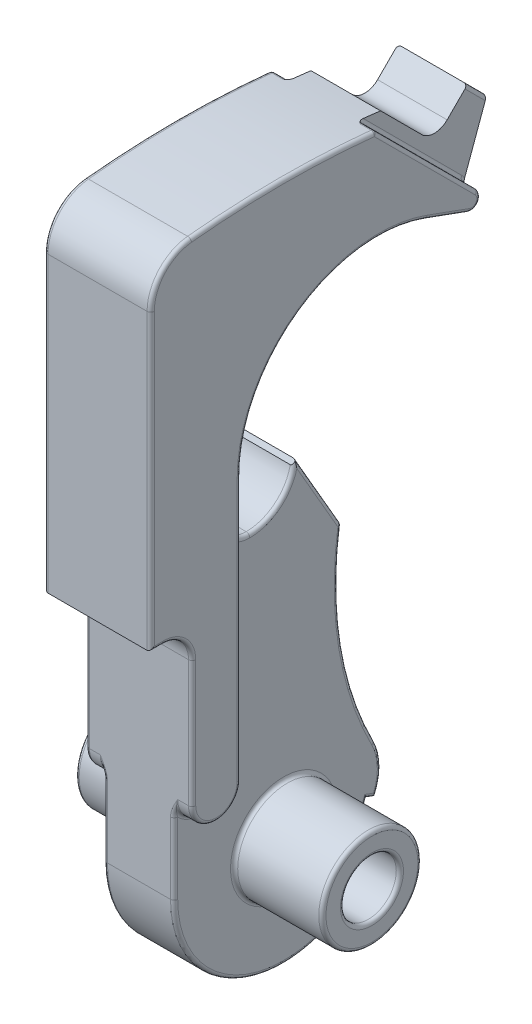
SolidWorks part; units mm, degrees
ref_plane "Front" through (0, 0, 0) normal (0, 0, 1) x (1, 0, 0)
ref_plane "Top" through (0, 0, 0) normal (0, 1, 0) x (1, 0, 0)
ref_plane "Right" through (0, 0, 0) normal (1, 0, 0) x (0, 0, -1)
sketch "Sketch1" plane through (0, 0, 0) normal (1, 0, 0) x (0, 0, -1)
  line L0 (0, 0) -> (16.1769, -5.8879) construction
  line L1 (7.2559, -2.6409) -> (5.3465, -1.946)
  line L2 (5.3465, -1.946) -> (5.8677, -0.5139)
  line L3 (5.8677, -0.5139) -> (6.4644, -0.731)
  line L4 (-4.2926, 30.0076) -> (-4.2926, 6.35) construction
  line L5 (0, 0) -> (-22.3437, 0) construction
  line L6 (-7.7216, 0) -> (-7.7216, 15.2654)
  line L7 (0, 0) -> (0, 17.145) construction
  line L8 (4.0854, 17.145) -> (0.9104, 22.6443)
  line L9 (-10.6426, 17.2974) -> (-9.7536, 17.2974)
  line L10 (-10.6426, 17.2974) -> (-10.6426, 37.9889)
  line L11 (-7.7256, 17.145) -> (4.0854, 17.145) construction
  line L12 (-10.6426, 41.4782) -> (5.2324, 41.4782) construction
  line L13 (-10.6426, 28.7569) -> (13.2334, 28.7569) construction
  line L14 (0, -7.7216) -> (-15.9042, -7.7216) construction
  line L15 (-10.6426, 17.2974) -> (-10.6426, 6.35) construction
  line L16 (-7.7892, 41.1476) -> (6.3959, 41.1476) construction
  line L17 (5.2324, 41.1476) -> (12.4166, 33.9634)
  line L18 (11.7504, 32.9177) -> (8.7669, 34.0036)
  line L19 (-4.2926, 24.8592) -> (-4.2926, 21.6842)
  line L20 (0.9104, 22.6443) -> (0.722, 22.3131)
  line L21 (0.722, 22.3131) -> (0.722, 19.7731) construction
  circle A0 centre (0, 0) radius 1.9685
  arc A1 (-7.7216, 0) -> (7.2559, -2.6409) centre (0, 0) ccw
  arc A2 (-7.7216, 15.2654) -> (-9.7536, 17.2974) centre (-9.7536, 15.2654) ccw
  arc A5 (-7.7892, 41.1476) -> (5.2324, 41.1476) centre (-1.2784, -22.7959) cw
  arc A6 (-10.6426, 37.9889) -> (-7.7892, 41.1476) centre (-7.4676, 37.9889) cw
  circle A7 centre (0, 0) radius 3.4925 construction
  arc A8 (-4.2926, 6.35) -> (-7.7216, 6.35) centre (-6.0071, 6.35) cw construction
  arc A9 (12.4166, 33.9634) -> (11.7504, 32.9177) centre (11.9676, 33.5144) cw
  arc A10 (8.7669, 34.0036) -> (-4.2926, 24.8592) centre (5.4386, 24.8592) ccw
  arc A11 (-4.2926, 21.6842) -> (-2.3876, 19.7792) centre (-2.3876, 21.6842) ccw
  arc A12 (0.722, 22.3131) -> (-2.3876, 19.7792) centre (-2.3876, 22.9542) cw
  arc A13 (6.4644, -0.731) -> (6.4394, 2.6916) centre (3.048, 0.9554) ccw
  arc A14 (4.0854, 17.145) -> (6.4394, 2.6916) centre (27.6925, 13.5715) ccw
  point P18 (-7.7256, 17.145)
  point P31 (-10.6426, 40.7924)
  dimension "D1" = 15.4432
  dimension "D2" = 3.937
  dimension "D7" = 2.032
  dimension "D16" = 10.9474
  dimension "D20" = 3.175
  dimension "D22" = 6.985
  dimension "D21" = 3.81
  dimension "D25" = 3.048
  dimension "D27" = 0.635
  dimension "D32" = 1.905
  dimension "D33" = 3.175
  dimension "D34" = 23.876
  dimension "D3" = 25.019
  dimension "D4" = 2.921
  dimension "D5" = 17.145
  dimension "D6" = 23.495
  dimension "D8" = 11.811
  dimension "D9" = 20
  dimension "D10" = 30
  dimension "D11" = 6.35
  dimension "D12" = 1.524
  dimension "D13" = 2.032
  dimension "D14" = 6.35
  dimension "D15" = 15.875
  dimension "D17" = 2.921
  dimension "D18" = 23.876
  dimension "D19" = 49.1998
  dimension "D23" = 45
  dimension "D24" = 0.635
  dimension "D26" = 10.16
  dimension "D28" = 3.175
  dimension "D29" = 70
  dimension "D30" = 2.54
  dimension "D31" = 0.381
  dimension "D35" = 27.5008
extrude "Boss-Extrude1" add sketch "Sketch1" along normal blind 2.4765
sketch "Sketch2" plane through (2.4765, 0, 0) normal (1, 0, 0) x (0, 0, -1)
  line L0 (-4.2926, 30.0076) -> (-4.2926, 6.35) construction
  line L1 (-4.2926, 21.6842) -> (-4.2926, 6.35)
  line L13 (0.9104, 22.6443) -> (0.722, 22.3131)
  line L14 (-4.2926, 21.6842) -> (-4.2926, 24.8592)
  line L15 (8.7669, 34.0036) -> (11.7504, 32.9177)
  line L16 (12.4166, 33.9634) -> (5.2324, 41.1476)
  line L17 (-10.6426, 37.9889) -> (-10.6426, 17.2974)
  line L18 (-10.6426, 17.2974) -> (-9.7536, 17.2974)
  line L19 (-7.7216, 15.2654) -> (-7.7216, 0)
  line L20 (7.2559, -2.6409) -> (5.3465, -1.946)
  line L21 (5.3465, -1.946) -> (5.8677, -0.5139)
  line L22 (5.8677, -0.5139) -> (6.4644, -0.731)
  line L23 (4.0854, 17.145) -> (0.9104, 22.6443)
  line L25 (-4.2926, 21.6842) -> (-4.2926, 24.8592)
  line L26 (8.7669, 34.0036) -> (11.7504, 32.9177)
  line L27 (12.4166, 33.9634) -> (5.2324, 41.1476)
  line L28 (-10.6426, 37.9889) -> (-10.6426, 17.2974)
  line L29 (-10.6426, 17.2974) -> (-9.7536, 17.2974)
  line L30 (-7.7216, 15.2654) -> (-7.7216, 6.35)
  arc A0 (-7.7216, 6.35) -> (-4.2926, 6.35) centre (-6.0071, 6.35) ccw construction
  arc A1 (-7.7216, 6.35) -> (-4.2926, 6.35) centre (-6.0071, 6.35) ccw
  arc A12 (-2.3876, 19.7792) -> (0.722, 22.3131) centre (-2.3876, 22.9542) ccw
  arc A13 (-4.2926, 21.6842) -> (-2.3876, 19.7792) centre (-2.3876, 21.6842) ccw
  arc A14 (8.7669, 34.0036) -> (-4.2926, 24.8592) centre (5.4386, 24.8592) ccw
  arc A15 (11.7504, 32.9177) -> (12.4166, 33.9634) centre (11.9676, 33.5144) ccw
  arc A16 (5.2324, 41.1476) -> (-7.7892, 41.1476) centre (-1.2784, -22.7959) ccw
  arc A17 (-7.7892, 41.1476) -> (-10.6426, 37.9889) centre (-7.4676, 37.9889) ccw
  arc A18 (-7.7216, 15.2654) -> (-9.7536, 17.2974) centre (-9.7536, 15.2654) ccw
  arc A19 (-7.7216, 0) -> (7.2559, -2.6409) centre (0, 0) ccw
  arc A20 (6.4644, -0.731) -> (6.4394, 2.6916) centre (3.048, 0.9554) ccw
  arc A21 (4.0854, 17.145) -> (6.4394, 2.6916) centre (27.6925, 13.5715) ccw
  arc A24 (8.7669, 34.0036) -> (-4.2926, 24.8592) centre (5.4386, 24.8592) ccw
  arc A25 (11.7504, 32.9177) -> (12.4166, 33.9634) centre (11.9676, 33.5144) ccw
  arc A26 (5.2324, 41.1476) -> (-7.7892, 41.1476) centre (-1.2784, -22.7959) ccw
  arc A27 (-7.7892, 41.1476) -> (-10.6426, 37.9889) centre (-7.4676, 37.9889) ccw
  arc A28 (-7.7216, 15.2654) -> (-9.7536, 17.2974) centre (-9.7536, 15.2654) ccw
  dimension "D1" = 0
extrude "Boss-Extrude2" add sketch "Sketch2" along normal blind 1.27
sketch "Sketch3" plane through (2.4765, 0, 0) normal (1, 0, 0) x (0, 0, -1)
  circle A0 centre (0, 0) radius 3.4925 construction
  circle A1 centre (0, 0) radius 3.4925
  circle A2 centre (0, 0) radius 1.9685 construction
  circle A3 centre (0, 0) radius 1.9685
extrude "Boss-Extrude3" add sketch "Sketch3" along normal blind 6.223
sketch "Sketch4" plane through (0, 0, 0) normal (-1, 0, 0) x (0, 0, 1)
  line L0 (-12.9851, 39.5014) -> (-14.3322, 38.1544)
  line L1 (-12.4166, 33.9634) -> (-5.2324, 41.1476) construction
  line L2 (-12.5643, 33.2972) -> (-14.3322, 38.1544)
  line L3 (-12.9851, 39.5014) -> (-11.5483, 38.0646)
  line L4 (-6.8554, 40.9615) -> (-9.7522, 38.0646)
  line L5 (-12.4166, 33.9634) -> (-5.2324, 41.1476)
  line L6 (0, 0) -> (0, 50.6391) construction
  arc A0 (-12.4166, 33.9634) -> (-11.7504, 32.9177) centre (-11.9676, 33.5144) ccw construction
  arc A1 (-5.2324, 41.1476) -> (-6.8554, 40.9615) centre (1.2784, -22.7959) ccw
  arc A2 (7.7892, 41.1476) -> (-5.2324, 41.1476) centre (1.2784, -22.7959) ccw construction
  arc A3 (-12.4166, 33.9634) -> (-12.5643, 33.2972) centre (-11.9676, 33.5144) ccw
  arc A4 (-11.5483, 38.0646) -> (-9.7522, 38.0646) centre (-10.6503, 38.9626) ccw
  dimension "D3" = 1.27
  dimension "D1" = 4.318
  dimension "D2" = 1.016
  dimension "D4" = 1.905
  dimension "D5" = 20
extrude "-Full Auto Trip-" add sketch "Sketch4" against normal blind 2.4511
fillet "Fillet1" radius 0.254 29 edges at (2.4765, 0.9832, -6.8579) (3.7465, 10.8077, 7.7216) (3.7465, 16.7022, 8.3168) (3.7465, 17.2974, 10.1981) (3.7465, 27.6432, 10.6426) (3.7465, 40.1172, 9.8236) (3.7465, 41.4782, 1.2784) (3.7465, 37.5555, -8.8245) (3.7465, 33.1732, -12.5031) (3.7465, 33.4606, -10.2586) (3.7465, 32.8306, 0.143) (3.7465, 15.6046, 4.2926) (3.7465, 4.6355, 6.0071) (2.4765, -0.6225, -6.1661) (2.4765, 20.4929, 0.382) (2.4765, 19.8946, -2.4979) (2.4765, -2.2935, -6.3012) (2.4765, -1.2299, -5.6071) (2.4765, 9.7334, -4.127) (2.4765, -7.6043, 1.3408) (2.4765, 0, 3.4925) (8.6995, 0, -1.9685) (8.6995, 0, -3.4925) (3.0988, 41.1476, -5.2324) (1.2383, 17.145, -4.0854)
fillet "Fillet2" radius 0.254 4 edges at (2.4511, 33.6518, -12.5875) (2.4511, 41.1335, -5.2256) (2.4511, 38.8279, -13.6587) (2.4511, 37.5235, -8.8565)
mirror "Mirror1"
